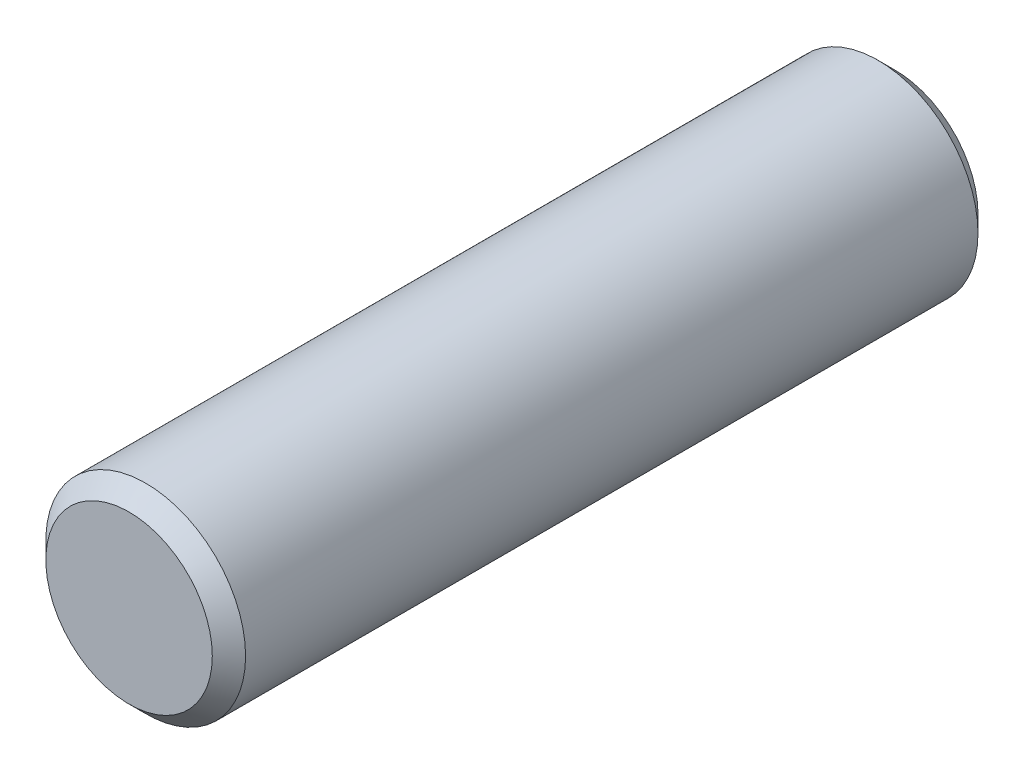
SolidWorks part; units mm, degrees
ref_plane "Face" through (0, 0, 0) normal (0, 0, 1) x (1, 0, 0)
ref_plane "Dessus" through (0, 0, 0) normal (0, 1, 0) x (1, 0, 0)
ref_plane "Droite" through (0, 0, 0) normal (1, 0, 0) x (0, 0, -1)
sketch "Esquisse1" plane through (0, 0, 0) normal (0, 0, 1) x (1, 0, 0)
  circle A0 centre (0, 0) radius 6
  dimension "D1" = 12
extrude "Base-Extrusion" add sketch "Esquisse1" along normal blind 46
chamfer "Chanfrein1" distance 1 angle 45
